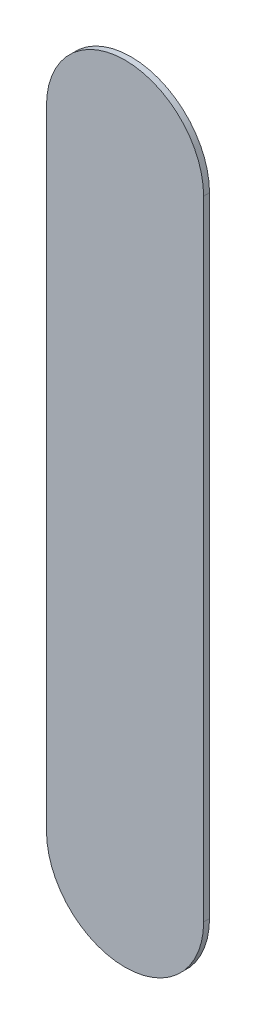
SolidWorks part; units mm, degrees
ref_plane "Plan de face" through (0, 0, 0) normal (0, 0, 1) x (1, 0, 0)
ref_plane "Plan de dessus" through (0, 0, 0) normal (0, 1, 0) x (1, 0, 0)
ref_plane "Plan de droite" through (0, 0, 0) normal (1, 0, 0) x (0, 0, -1)
sketch "Esquisse1" plane through (0, 0, 0) normal (0, 0, 1) x (1, 0, 0)
  line L0 (0, 0) -> (0, 320) construction
  line L1 (-40, 0) -> (-40, 320)
  line L2 (40, 0) -> (40, 320)
  arc A0 (-40, 0) -> (40, 0) centre (0, 0) ccw
  arc A1 (40, 320) -> (-40, 320) centre (0, 320) ccw
  point P3 (0, 160)
  dimension "D2" = 40
  dimension "D1" = 320
extrude "Boss.-Extru.1" add sketch "Esquisse1" along normal blind 3
